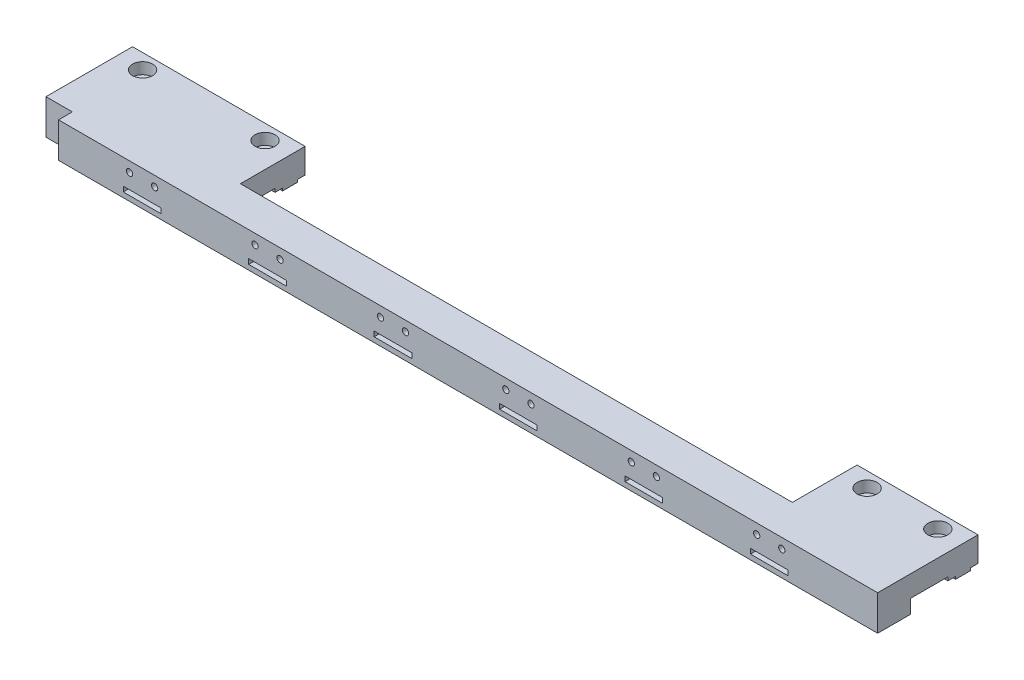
SolidWorks part; units mm, degrees
ref_plane "前视基准面" through (0, 0, 0) normal (0, 0, 1) x (1, 0, 0)
ref_plane "上视基准面" through (0, 0, 0) normal (0, 1, 0) x (1, 0, 0)
ref_plane "右视基准面" through (0, 0, 0) normal (1, 0, 0) x (0, 0, -1)
sketch "草图1" plane through (0, 0, 0) normal (0, 0, 1) x (1, 0, 0)
  line L0 (0, 0) -> (337, 0)
  line L1 (0, 14) -> (337, 14)
  line L2 (337, 0) -> (337, 14)
  line L3 (0, 0) -> (0, 14)
extrude "凸台-拉伸1" add sketch "草图1" along normal blind 40
sketch "草图2" plane through (0, 0, 40) normal (0, 0, 1) x (1, 0, 0)
  line L0 (36.3, 2) -> (51.3, 2)
  line L1 (36.3, 4) -> (51.3, 4)
  line L2 (36.3, 4) -> (36.3, 2)
  line L3 (51.3, 4) -> (51.3, 2)
  line L4 (86.3, 4) -> (101.3, 4)
  line L5 (86.3, 2) -> (101.3, 2)
  line L6 (86.3, 4) -> (86.3, 2)
  line L7 (101.3, 4) -> (101.3, 2)
  line L8 (136.3, 4) -> (151.3, 4)
  line L9 (136.3, 2) -> (151.3, 2)
  line L10 (136.3, 4) -> (136.3, 2)
  line L11 (151.3, 4) -> (151.3, 2)
  line L12 (186.3, 4) -> (201.3, 4)
  line L13 (186.3, 2) -> (201.3, 2)
  line L14 (186.3, 4) -> (186.3, 2)
  line L15 (201.3, 4) -> (201.3, 2)
  line L16 (236.3, 4) -> (251.3, 4)
  line L17 (236.3, 2) -> (251.3, 2)
  line L18 (236.3, 4) -> (236.3, 2)
  line L19 (251.3, 4) -> (251.3, 2)
  line L20 (286.3, 4) -> (301.3, 4)
  line L21 (286.3, 2) -> (301.3, 2)
  line L22 (286.3, 4) -> (286.3, 2)
  line L23 (301.3, 4) -> (301.3, 2)
extrude "切除-拉伸1" cut sketch "草图2" against normal blind 40
sketch "草图3" plane through (0, 0, 40) normal (0, 0, 1) x (1, 0, 0)
  circle A0 centre (38.8, 10) radius 1.25
  circle A1 centre (48.8, 10) radius 1.25
  circle A2 centre (88.8, 10) radius 1.25
  circle A3 centre (98.8, 10) radius 1.25
  circle A4 centre (138.8, 10) radius 1.25
  circle A5 centre (148.8, 10) radius 1.25
  circle A6 centre (188.8, 10) radius 1.25
  circle A7 centre (198.8, 10) radius 1.25
  circle A8 centre (238.8, 10) radius 1.25
  circle A9 centre (248.8, 10) radius 1.25
  circle A10 centre (288.8, 10) radius 1.25
  circle A11 centre (298.8, 10) radius 1.25
extrude "切除-拉伸2" cut sketch "草图3" against normal blind 15
sketch "草图4" plane through (337, 0, 0) normal (1, 0, 0) x (0, 0, -1)
  line L0 (-3, 3.1) -> (-3, 4.1)
  line L1 (-9, 3.1) -> (-9, 4.1)
  line L2 (0, 4.1) -> (0, 14)
  line L3 (-12, 4.1) -> (-12, 5.5)
  line L4 (-27, 5.5) -> (-12, 5.5)
  line L5 (-40, 0) -> (-27, 0)
  line L6 (-40, 14) -> (0, 14)
  line L7 (-27, 0) -> (-27, 5.5)
  line L8 (-40, 0) -> (-40, 14)
  line L9 (-9, 3.1) -> (-3, 3.1)
  line L10 (-12, 4.1) -> (-9, 4.1)
  line L11 (-3, 4.1) -> (0, 4.1)
extrude "切除-拉伸3" cut sketch "草图4" against normal through all flip side to cut
sketch "草图5" plane through (0, 14, 0) normal (0, 1, 0) x (1, 0, 0)
  line L0 (0, 0) -> (68.8, 0)
  line L1 (10.5, -40) -> (337, -40)
  line L2 (0, -34.5) -> (0, 0)
  line L3 (337, -40) -> (337, 0)
  line L4 (68.8, -25.8) -> (68.8, 0)
  line L5 (288.8, -25.8) -> (288.8, 0)
  line L6 (288.8, 0) -> (337, 0)
  line L7 (68.8, -25.8) -> (288.8, -25.8)
  line L8 (10.5, -40) -> (10.5, -34.5)
  line L9 (0, -34.5) -> (10.5, -34.5)
  circle A0 centre (298.8, -6) radius 2.25
  circle A1 centre (327, -6) radius 2.25
  circle A2 centre (10, -6) radius 2.25
  circle A3 centre (58.8, -6) radius 2.25
extrude "切除-拉伸4" cut sketch "草图5" against normal through all flip side to cut
sketch "草图6" plane through (0, 14, 0) normal (0, 1, 0) x (1, 0, 0)
  circle A0 centre (298.8, -6) radius 4
  circle A1 centre (327, -6) radius 4
  circle A2 centre (10, -6) radius 4
  circle A3 centre (58.8, -6) radius 4
extrude "切除-拉伸5" cut sketch "草图6" against normal blind 4.5
